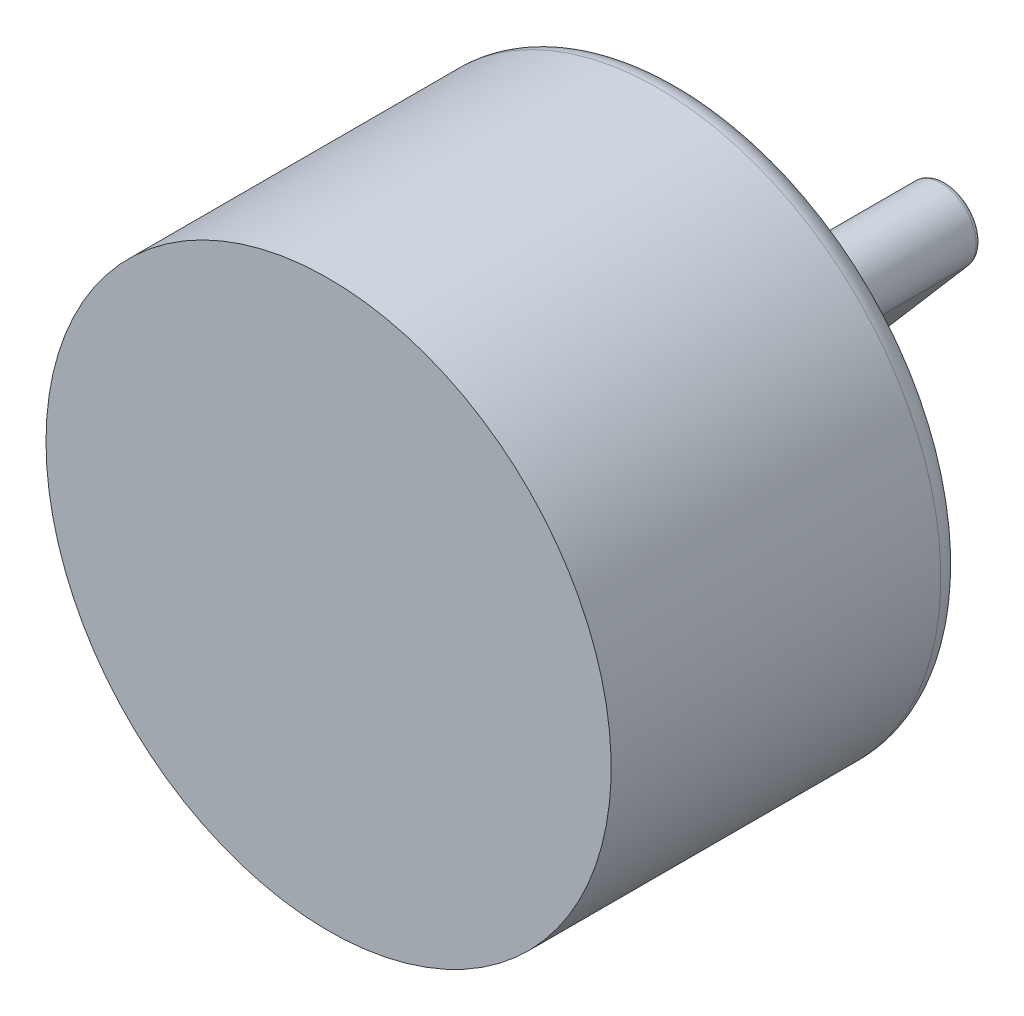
SolidWorks part; units mm, degrees
ref_plane "Front Plane" through (0, 0, 0) normal (0, 0, 1) x (1, 0, 0)
ref_plane "Top Plane" through (0, 0, 0) normal (0, 1, 0) x (1, 0, 0)
ref_plane "Right Plane" through (0, 0, 0) normal (1, 0, 0) x (0, 0, -1)
body saved out of another part "Stock-Mobile-1"
